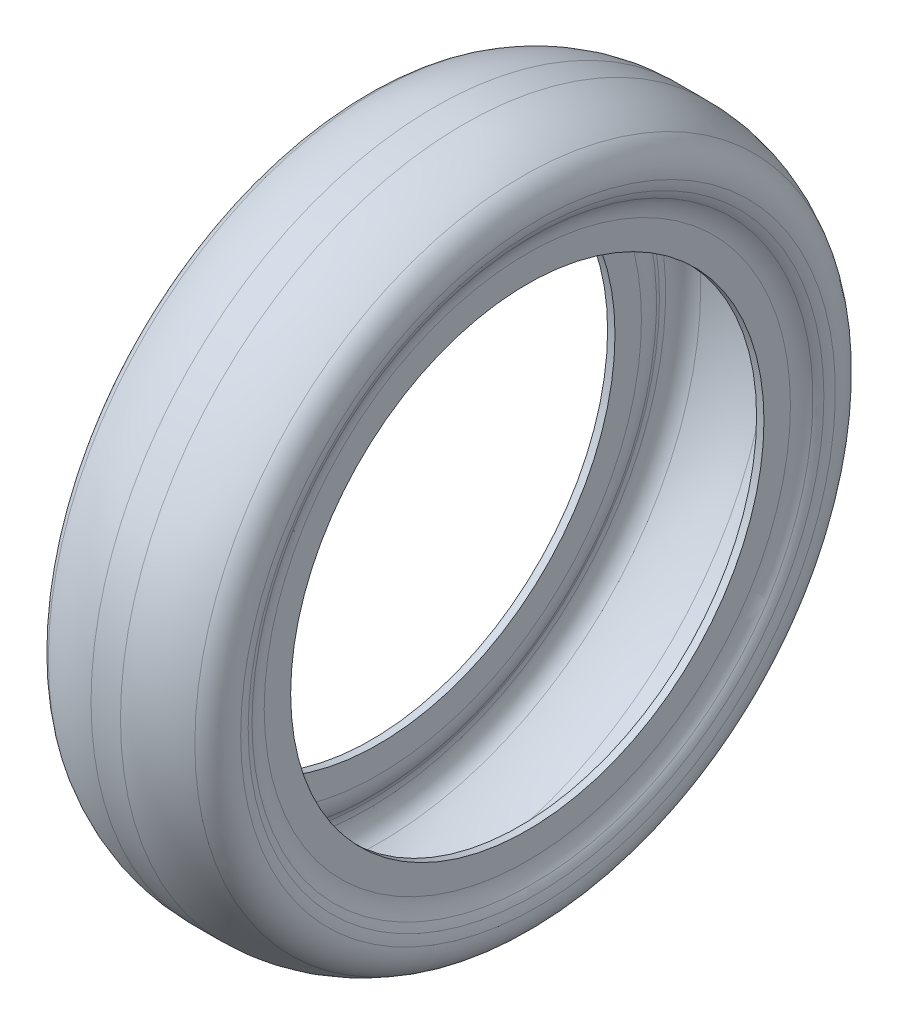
SolidWorks part; units mm, degrees
ref_plane "Plan1" through (0, 0, 0) normal (0, 0, 1) x (1, 0, 0)
ref_plane "Plan2" through (0, 0, 0) normal (0, 1, 0) x (1, 0, 0)
ref_plane "Plan3" through (0, 0, 0) normal (1, 0, 0) x (0, 0, -1)
sketch "Esquisse1" plane through (0, 0, 0) normal (0, 0, 1) x (1, 0, 0)
  line L0 (-74, 224) -> (-74, 249.0493)
  line L2 (0, 220) -> (0, 365.4365) construction
  line L4 (-13.9322, 325) -> (13.9322, 325)
  line L5 (74, 224) -> (74, 249.0493)
  line L9 (130.1362, 0) -> (199.1451, 0) construction
  arc A0 (-74, 249.0493) -> (-78.8848, 265.4573) centre (-104, 249.0493) ccw
  arc A1 (-78.8848, 265.4573) -> (-82.2576, 272.4616) centre (-53.7695, 281.8654) cw
  arc A2 (-82.2576, 272.4616) -> (-84.1138, 281.4286) centre (-44.2735, 285) cw
  arc A3 (69.3466, 310.0223) -> (84.1138, 281.4286) centre (54.2336, 284.1072) cw
  arc A4 (13.9322, 325) -> (69.3466, 310.0223) centre (13.9322, 215) cw
  arc A5 (82.2576, 272.4616) -> (84.1138, 281.4286) centre (44.2735, 285) ccw
  arc A6 (-13.9322, 325) -> (-69.3466, 310.0223) centre (-13.9322, 215) ccw
  arc A7 (-69.3466, 310.0223) -> (-84.1138, 281.4286) centre (-54.2336, 284.1072) ccw
  arc A8 (78.8848, 265.4573) -> (82.2576, 272.4616) centre (53.7695, 281.8654) ccw
  arc A9 (74, 249.0493) -> (78.8848, 265.4573) centre (104, 249.0493) cw
  point P26 (5.2978, 325)
  point P40 (0, 325)
  dimension "D1" = 325
  dimension "D2" = 9
  dimension "D3" = 13.9322
  dimension "D4" = 30
  dimension "D5" = 40
  dimension "D6" = 30
  dimension "D8" = 30
  dimension "D9" = 110
  dimension "D7" = 25.0493
  dimension "D10" = 168.2275
  dimension "D11" = 74
revolve "Base-Révol.-Mince" add sketch "Esquisse1" angle 360 about L9
